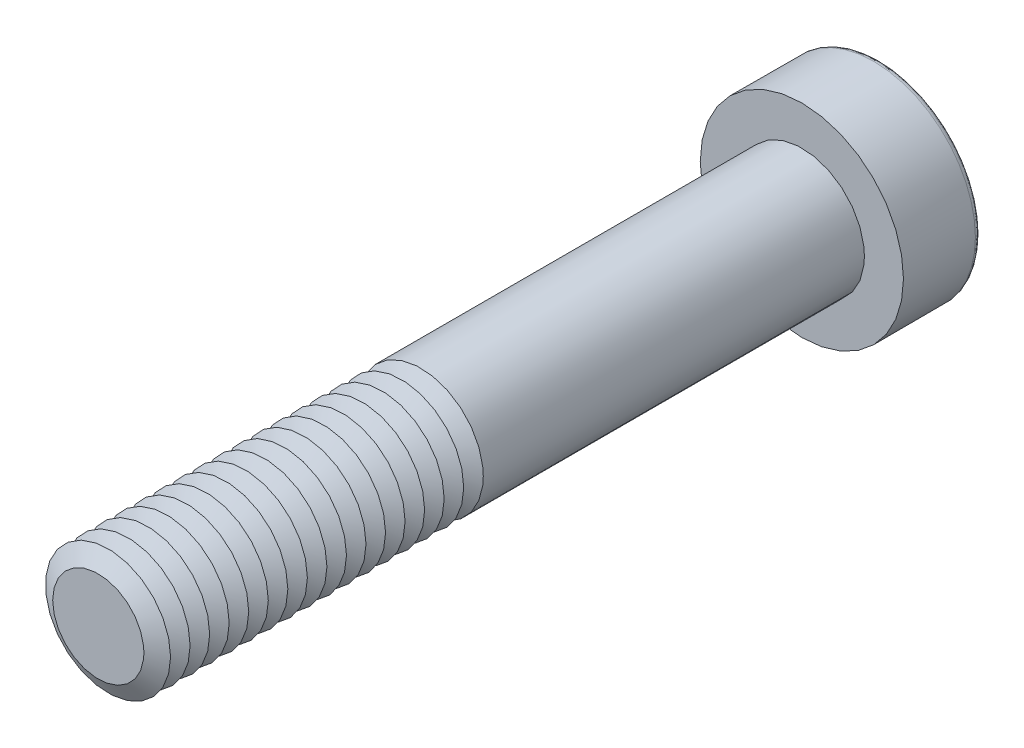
SolidWorks part; units mm, degrees
ref_plane "Front Plane" through (0, 0, 0) normal (0, 0, 1) x (1, 0, 0)
ref_plane "Top Plane" through (0, 0, 0) normal (0, 1, 0) x (1, 0, 0)
ref_plane "Right Plane" through (0, 0, 0) normal (1, 0, 0) x (0, 0, -1)
sketch "Sketch1" plane through (0, 0, 0) normal (0, 0, 1) x (1, 0, 0)
  circle A0 centre (0, 0) radius 4
  dimension "D1" = 8
extrude "Boss-Extrude1" add sketch "Sketch1" along normal blind 45
sketch "Sketch2" plane through (0, 0, 0) normal (0, 0, -1) x (-1, 0, 0)
  circle A0 centre (0, 0) radius 6.5
  dimension "D1" = 13
extrude "Boss-Extrude2" add sketch "Sketch2" along normal blind 5
sketch "Sketch3" plane through (0, 0, -5) normal (0, 0, -1) x (-1, 0, 0)
  line L1 (-1.4434, 2.5) -> (-2.8868, 0)
  line L2 (-2.8868, 0) -> (-1.4434, -2.5)
  line L3 (-1.4434, -2.5) -> (1.4434, -2.5)
  line L4 (1.4434, -2.5) -> (2.8868, 0)
  line L5 (2.8868, 0) -> (1.4434, 2.5)
  line L6 (1.4434, 2.5) -> (-1.4434, 2.5)
  circle A0 centre (0, 0) radius 2.5 construction
  dimension "D1" = 5
extrude "Cut-Extrude1" cut sketch "Sketch3" against normal blind 3.75
fillet "Fillet1" radius 0.4 1 edges at (-6.5, 0, -5)
sketch "Sketch4" plane through (0, 0, -1.25) normal (0, 0, -1) x (-1, 0, 0)
  line L0 (1.4434, -2.5) -> (2.8868, 0) construction
  circle A0 centre (0, 0) radius 2.5
extrude "Cut-Extrude2" cut sketch "Sketch4" against normal through all draft 60
sketch "Sketch5" plane through (0, 0, -5) normal (0, 0, -1) x (-1, 0, 0)
  circle A0 centre (0, 0) radius 2.8868
extrude "Cut-Extrude3" cut sketch "Sketch5" against normal through all draft 75
sketch "Sketch7" plane through (0, 0, 0) normal (1, 0, 0) x (0, 0, -1)
  line L25 (-45, 2.9175) -> (-44.375, 4)
  line L26 (-45, 4) -> (-45, -4) construction
  line L27 (-44.375, 4) -> (-45.625, 4)
  line L28 (-45.625, 4) -> (-45, 2.9175)
  line L29 (0, 4) -> (-45, 4) construction
  dimension "D1" = 1.25
revolve "Cut-Revolve1" cut sketch "Sketch7" angle 360 about axis through (0, 0, 45) along (0, 0, -1)
pattern_linear "LPattern1" count 17 spacing 1.25 along (0, 0, -1) of "Cut-Revolve1"
